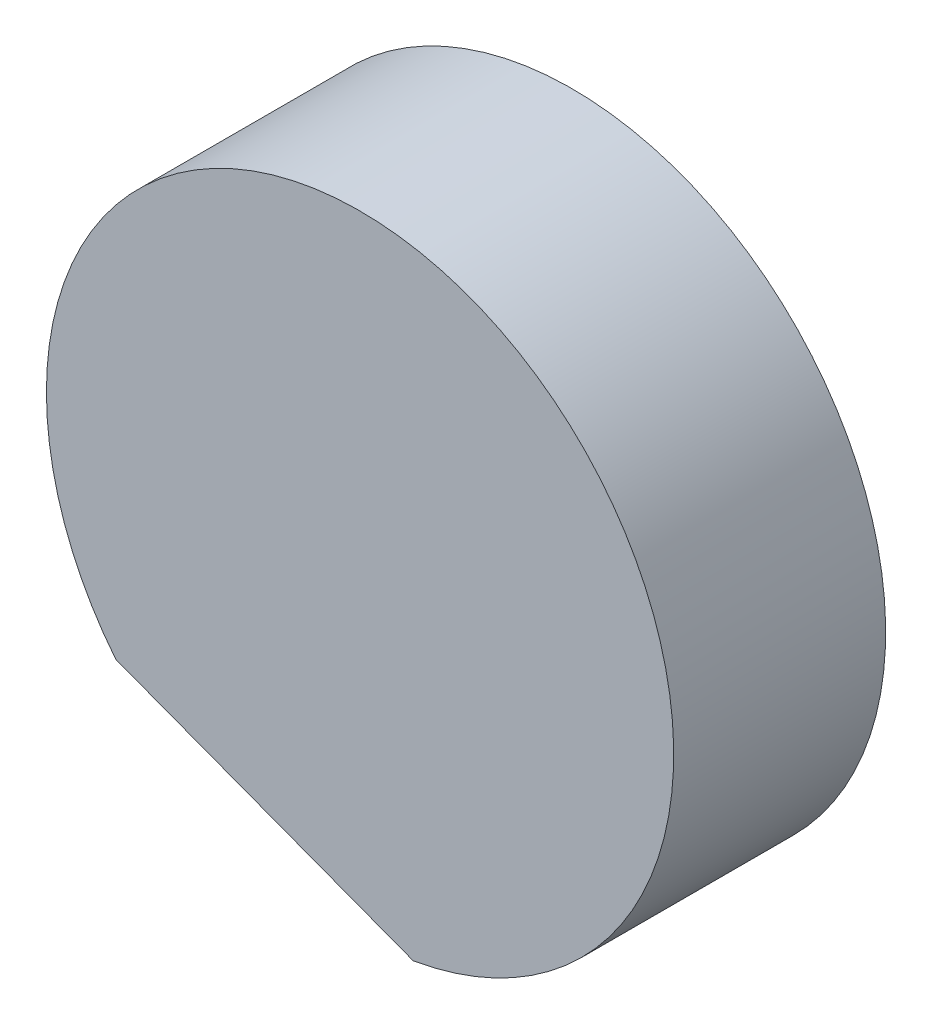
SolidWorks part; units mm, degrees
ref_plane "Front Plane" through (0, 0, 0) normal (0, 0, 1) x (1, 0, 0)
ref_plane "Top Plane" through (0, 0, 0) normal (0, 1, 0) x (1, 0, 0)
ref_plane "Right Plane" through (0, 0, 0) normal (1, 0, 0) x (0, 0, -1)
sketch "Sketch1" plane through (0, 0, 0) normal (0, 0, 1) x (1, 0, 0)
  line L0 (-29.2695, -23.5804) -> (6.373, -37.0422)
  circle A0 centre (0, 0) radius 37.5864
  dimension "D1" = 75.1729
  dimension "D3" = 38.1
extrude "Extrude1" add sketch "Sketch1" along normal blind 25.4
